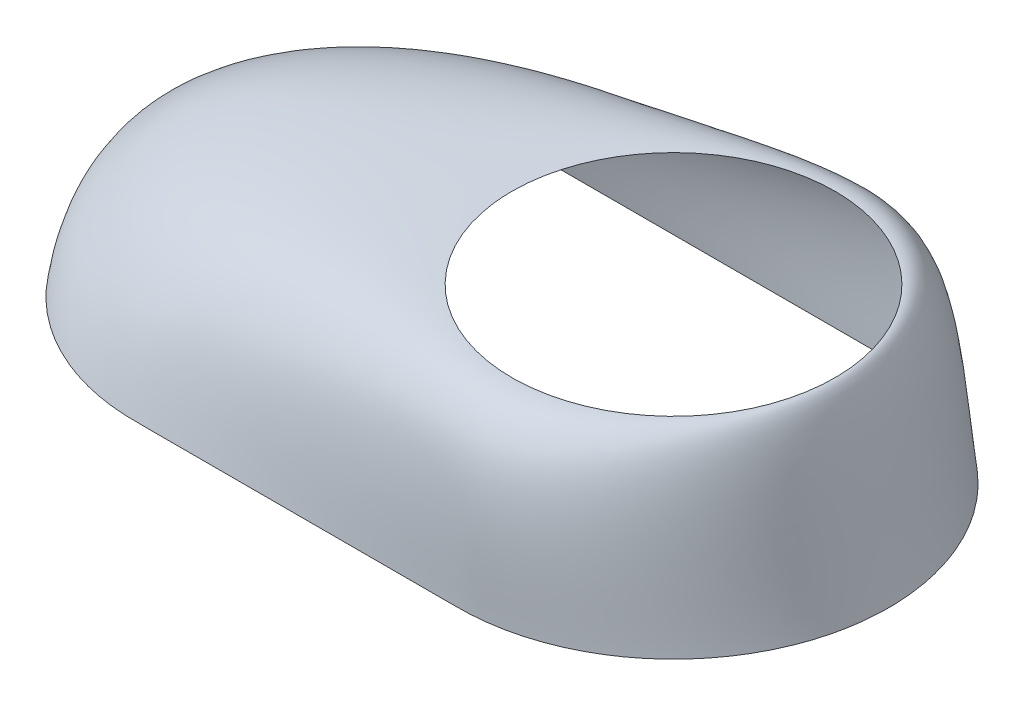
SolidWorks part; units mm, degrees
ref_plane "Front Plane" through (0, 0, 0) normal (0, 0, 1) x (1, 0, 0)
ref_plane "Top Plane" through (0, 0, 0) normal (0, 1, 0) x (1, 0, 0)
ref_plane "Right Plane" through (0, 0, 0) normal (1, 0, 0) x (0, 0, -1)
sketch3d "3DSketch2"
  line L0 (0, 0, 50) -> (0, 0, -50) construction
  line L1 (-75, 0, -50) -> (-75, 0, 50) construction
  line L2 (-75, 0, -50) -> (0, 0, -50)
  line L3 (-75, 0, 50) -> (0, 0, 50)
  line L4 (0, 40, 37.5) -> (0, 40, -37.5) construction
  line L5 (0, 0, 50) -> (0, -37.6865, 50) construction
  line L6 (0, 0, -50) -> (0, -37.6865, -50) construction
  line L7 (0, 0, 0) -> (0, -37.6865, 0) construction
  line L8 (-125, 0, 0) -> (-125, -19.5284, 0) construction
  line L9 (-37.5, 40, 0) -> (37.5, 40, 0) construction
  arc A0 (-75, 0, -50) -> (-75, 0, 50) centre (-75, 0, 0) ccw
  arc A1 (0, 0, -50) -> (0, 0, 50) centre (0, 0, 0) ccw
  circle A2 centre (0, 40, 0) radius 37.5
  spline S0 degree 3 poles (0, 40, 37.5) (0, 40, 51.9382) (0, 13.9692, 50) (0, 0, 50) knots 0 0 0 0 1 1 1 1
  spline S1 degree 3 poles (0, 0, -50) (0, 13.9692, -50) (0, 40, -51.9382) (0, 40, -37.5) knots 0 0 0 0 1 1 1 1
  spline S2 degree 3 poles (-37.5, 40, 0) (-81.4293, 40, 0) (-125, 32.0698, 0) (-125, 0, 0) knots 0 0 0 0 1 1 1 1
  point P6 (-75, 50, 0)
  point P8 (0, -50, 0)
  point P11 (0, 77.5, 0)
  dimension "D2" = 50
  dimension "D4" = 75
  dimension "D1" = 75
  dimension "D3" = 40
surface "Surface-Loft1"
